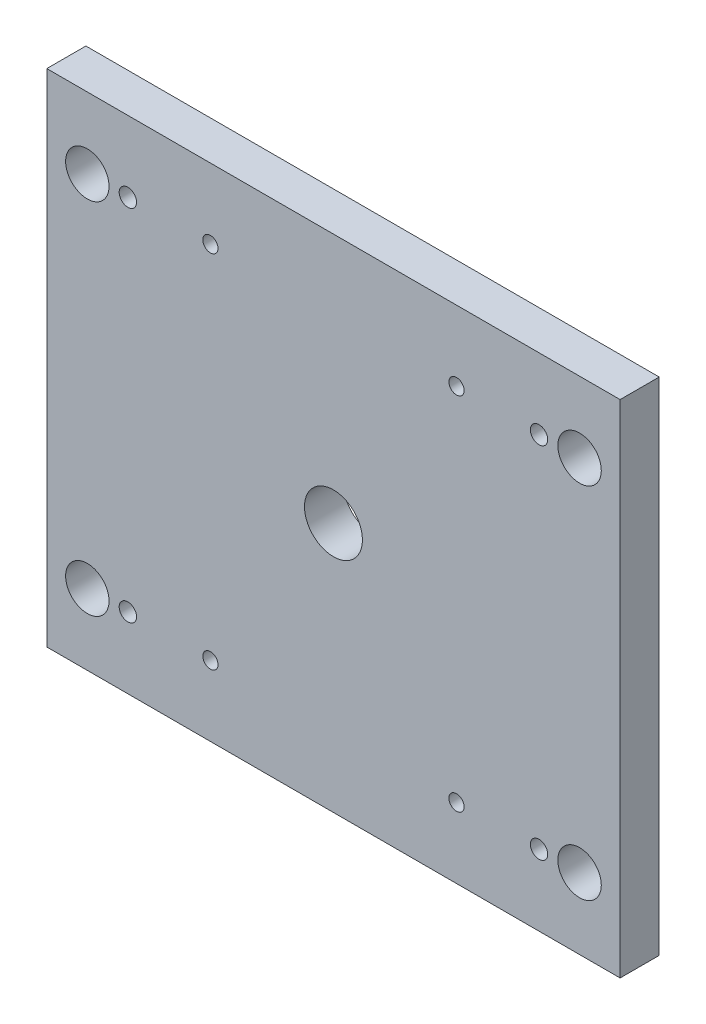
SolidWorks part; units mm, degrees
ref_plane "Plan de face" through (0, 0, 0) normal (0, 0, 1) x (1, 0, 0)
ref_plane "Plan de dessus" through (0, 0, 0) normal (0, 1, 0) x (1, 0, 0)
ref_plane "Plan de droite" through (0, 0, 0) normal (1, 0, 0) x (0, 0, -1)
ref_plane "Plan1" through (0, 0, -195) normal (0, 0, -1) x (-1, 0, 0)
sketch "Esquisse1" plane through (0, 0, -195) normal (0, 0, -1) x (-1, 0, 0)
  line L0 (198, -173) -> (198, 173)
  line L1 (198, 173) -> (-198, 173)
  line L2 (-198, 173) -> (-198, -173)
  line L3 (-198, -173) -> (198, -173)
extrude "Boss.-Extru.1" add sketch "Esquisse1" against normal blind 27
hole_wizard "Perçage1" positions "Esquisse3" profile "Esquisse2" legacy
sketch "Esquisse3" plane through (0, 0, -195) normal (0, 0, -1) x (-1, 0, 0)
  point P0 (-85, -124.5)
sketch "Esquisse2" plane through (85, -124.5, -195) normal (1, 0, 0) x (0, 1, 0)
  line L0 (0, 0) -> (0, 27)
  line L1 (0, 27) -> (5.25, 27)
  line L2 (5.25, 27) -> (5.25, 11)
  line L3 (5.25, 11) -> (8.5, 11)
  line L4 (8.5, 11) -> (8.5, 0)
  line L5 (8.5, 0) -> (0, 0)
  line L6 (0, 110) -> (0, -10) construction
  dimension "Diamètre" = 10.5
  dimension "Profondeur" = 27
  dimension "Diamètre chambrage" = 17
  dimension "Profondeur chambrage" = 11
hole_wizard "Perçage2" positions "Esquisse5" profile "Esquisse4" legacy
sketch "Esquisse5" plane through (0, 0, -195) normal (0, 0, -1) x (-1, 0, 0)
  point P0 (85, -124.5)
sketch "Esquisse4" plane through (-85, -124.5, -195) normal (1, 0, 0) x (0, 1, 0)
  line L0 (0, 0) -> (0, 27)
  line L1 (0, 27) -> (5.25, 27)
  line L2 (5.25, 27) -> (5.25, 11)
  line L3 (5.25, 11) -> (8.5, 11)
  line L4 (8.5, 11) -> (8.5, 0)
  line L5 (8.5, 0) -> (0, 0)
  line L6 (0, 110) -> (0, -10) construction
  dimension "Diamètre" = 10.5
  dimension "Profondeur" = 27
  dimension "Diamètre chambrage" = 17
  dimension "Profondeur chambrage" = 11
hole_wizard "Perçage3" positions "Esquisse7" profile "Esquisse6" legacy
sketch "Esquisse7" plane through (0, 0, -195) normal (0, 0, -1) x (-1, 0, 0)
  point P0 (85, 124.5)
sketch "Esquisse6" plane through (-85, 124.5, -195) normal (1, 0, 0) x (0, 1, 0)
  line L0 (0, 0) -> (0, 27)
  line L1 (0, 27) -> (5.25, 27)
  line L2 (5.25, 27) -> (5.25, 11)
  line L3 (5.25, 11) -> (8.5, 11)
  line L4 (8.5, 11) -> (8.5, 0)
  line L5 (8.5, 0) -> (0, 0)
  line L6 (0, 110) -> (0, -10) construction
  dimension "Diamètre" = 10.5
  dimension "Profondeur" = 27
  dimension "Diamètre chambrage" = 17
  dimension "Profondeur chambrage" = 11
hole_wizard "Perçage4" positions "Esquisse9" profile "Esquisse8" legacy
sketch "Esquisse9" plane through (0, 0, -195) normal (0, 0, -1) x (-1, 0, 0)
  point P0 (-85, 124.5)
sketch "Esquisse8" plane through (85, 124.5, -195) normal (1, 0, 0) x (0, 1, 0)
  line L0 (0, 0) -> (0, 27)
  line L1 (0, 27) -> (5.25, 27)
  line L2 (5.25, 27) -> (5.25, 11)
  line L3 (5.25, 11) -> (8.5, 11)
  line L4 (8.5, 11) -> (8.5, 0)
  line L5 (8.5, 0) -> (0, 0)
  line L6 (0, 110) -> (0, -10) construction
  dimension "Diamètre" = 10.5
  dimension "Profondeur" = 27
  dimension "Diamètre chambrage" = 17
  dimension "Profondeur chambrage" = 11
hole_wizard "Perçage5" positions "Esquisse11" profile "Esquisse10" legacy
sketch "Esquisse11" plane through (0, 0, -195) normal (0, 0, -1) x (-1, 0, 0)
  point P0 (0, 0)
sketch "Esquisse10" plane through (0, 0, -195) normal (1, 0, 0) x (0, 1, 0)
  line L0 (0, 0) -> (0, 27)
  line L1 (0, 27) -> (20, 27)
  line L2 (20, 27) -> (20, 0)
  line L3 (20, 0) -> (0, 0)
  line L4 (0, 110) -> (0, -10) construction
  dimension "Diamètre" = 40
  dimension "Profondeur" = 27
hole_wizard "Perçage6" positions "Esquisse13" profile "Esquisse12" legacy
sketch "Esquisse13" plane through (0, 0, -195) normal (0, 0, -1) x (-1, 0, 0)
  point P0 (-142, 124)
sketch "Esquisse12" plane through (142, 124, -195) normal (1, 0, 0) x (0, 1, 0)
  line L0 (0, 0) -> (0, 27)
  line L1 (0, 27) -> (6, 27)
  line L2 (6, 27) -> (6, 15.5)
  line L3 (6, 15.5) -> (9, 15.5)
  line L4 (9, 15.5) -> (9, 0)
  line L5 (9, 0) -> (0, 0)
  line L6 (0, 110) -> (0, -10) construction
  dimension "Diamètre" = 12
  dimension "Profondeur" = 27
  dimension "Diamètre chambrage" = 18
  dimension "Profondeur chambrage" = 15.5
hole_wizard "Perçage7" positions "Esquisse15" profile "Esquisse14" legacy
sketch "Esquisse15" plane through (0, 0, -195) normal (0, 0, -1) x (-1, 0, 0)
  point P0 (142, -124)
sketch "Esquisse14" plane through (-142, -124, -195) normal (1, 0, 0) x (0, 1, 0)
  line L0 (0, 0) -> (0, 27)
  line L1 (0, 27) -> (6, 27)
  line L2 (6, 27) -> (6, 15.5)
  line L3 (6, 15.5) -> (9, 15.5)
  line L4 (9, 15.5) -> (9, 0)
  line L5 (9, 0) -> (0, 0)
  line L6 (0, 110) -> (0, -10) construction
  dimension "Diamètre" = 12
  dimension "Profondeur" = 27
  dimension "Diamètre chambrage" = 18
  dimension "Profondeur chambrage" = 15.5
hole_wizard "Perçage8" positions "Esquisse17" profile "Esquisse16" legacy
sketch "Esquisse17" plane through (0, 0, -195) normal (0, 0, -1) x (-1, 0, 0)
  point P0 (142, 124)
sketch "Esquisse16" plane through (-142, 124, -195) normal (1, 0, 0) x (0, 1, 0)
  line L0 (0, 0) -> (0, 27)
  line L1 (0, 27) -> (6, 27)
  line L2 (6, 27) -> (6, 15.5)
  line L3 (6, 15.5) -> (9, 15.5)
  line L4 (9, 15.5) -> (9, 0)
  line L5 (9, 0) -> (0, 0)
  line L6 (0, 110) -> (0, -10) construction
  dimension "Diamètre" = 12
  dimension "Profondeur" = 27
  dimension "Diamètre chambrage" = 18
  dimension "Profondeur chambrage" = 15.5
hole_wizard "Perçage9" positions "Esquisse19" profile "Esquisse18" legacy
sketch "Esquisse19" plane through (0, 0, -195) normal (0, 0, -1) x (-1, 0, 0)
  point P0 (-142, -124)
sketch "Esquisse18" plane through (142, -124, -195) normal (1, 0, 0) x (0, 1, 0)
  line L0 (0, 0) -> (0, 27)
  line L1 (0, 27) -> (6, 27)
  line L2 (6, 27) -> (6, 15.5)
  line L3 (6, 15.5) -> (9, 15.5)
  line L4 (9, 15.5) -> (9, 0)
  line L5 (9, 0) -> (0, 0)
  line L6 (0, 110) -> (0, -10) construction
  dimension "Diamètre" = 12
  dimension "Profondeur" = 27
  dimension "Diamètre chambrage" = 18
  dimension "Profondeur chambrage" = 15.5
hole_wizard "Perçage10" positions "Esquisse21" profile "Esquisse20" legacy
sketch "Esquisse21" plane through (0, 0, -168) normal (0, 0, 1) x (1, 0, 0)
  point P0 (170, 124)
sketch "Esquisse20" plane through (170, 124, -168) normal (1, 0, 0) x (0, -1, 0)
  line L0 (0, 0) -> (0, 27)
  line L1 (0, 27) -> (15, 27)
  line L2 (15, 27) -> (15, 0)
  line L3 (15, 0) -> (0, 0)
  line L4 (0, 110) -> (0, -10) construction
  dimension "Diamètre" = 30
  dimension "Profondeur" = 27
hole_wizard "Perçage11" positions "Esquisse23" profile "Esquisse22" legacy
sketch "Esquisse23" plane through (0, 0, -168) normal (0, 0, 1) x (1, 0, 0)
  point P0 (-170, 124)
sketch "Esquisse22" plane through (-170, 124, -168) normal (1, 0, 0) x (0, -1, 0)
  line L0 (0, 0) -> (0, 27)
  line L1 (0, 27) -> (15, 27)
  line L2 (15, 27) -> (15, 0)
  line L3 (15, 0) -> (0, 0)
  line L4 (0, 110) -> (0, -10) construction
  dimension "Diamètre" = 30
  dimension "Profondeur" = 27
hole_wizard "Perçage12" positions "Esquisse25" profile "Esquisse24" legacy
sketch "Esquisse25" plane through (0, 0, -168) normal (0, 0, 1) x (1, 0, 0)
  point P0 (-170, -124)
sketch "Esquisse24" plane through (-170, -124, -168) normal (1, 0, 0) x (0, -1, 0)
  line L0 (0, 0) -> (0, 27)
  line L1 (0, 27) -> (15, 27)
  line L2 (15, 27) -> (15, 0)
  line L3 (15, 0) -> (0, 0)
  line L4 (0, 110) -> (0, -10) construction
  dimension "Diamètre" = 30
  dimension "Profondeur" = 27
hole_wizard "Perçage13" positions "Esquisse27" profile "Esquisse26" legacy
sketch "Esquisse27" plane through (0, 0, -168) normal (0, 0, 1) x (1, 0, 0)
  point P0 (170, -124)
sketch "Esquisse26" plane through (170, -124, -168) normal (1, 0, 0) x (0, -1, 0)
  line L0 (0, 0) -> (0, 27)
  line L1 (0, 27) -> (15, 27)
  line L2 (15, 27) -> (15, 0)
  line L3 (15, 0) -> (0, 0)
  line L4 (0, 110) -> (0, -10) construction
  dimension "Diamètre" = 30
  dimension "Profondeur" = 27
